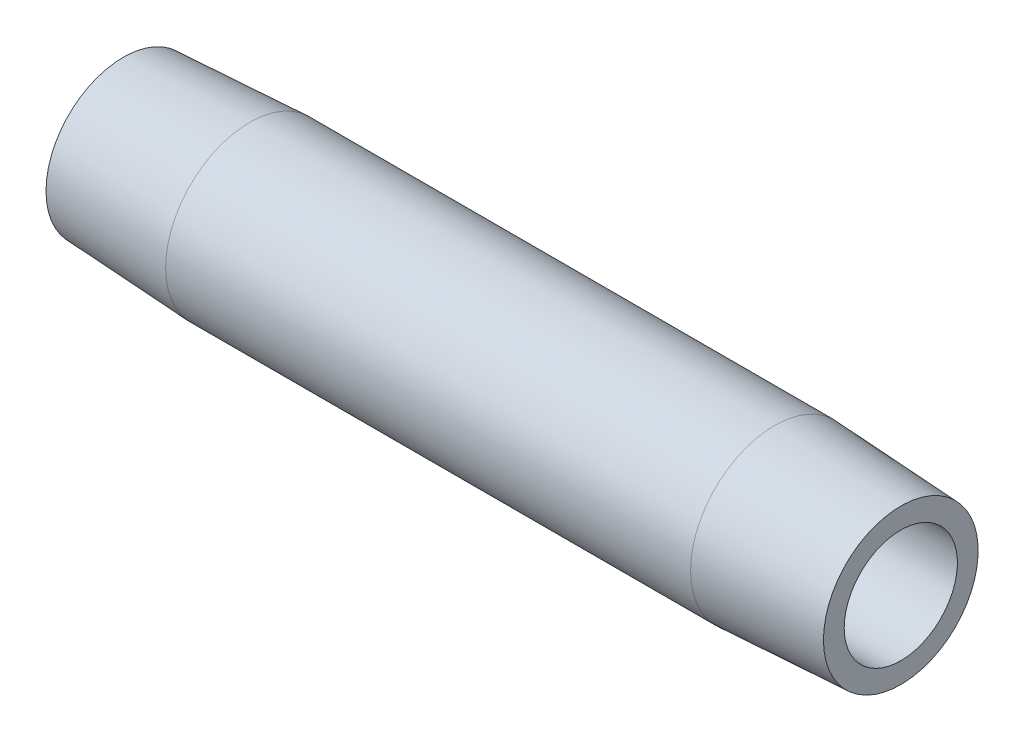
SolidWorks part; units mm, degrees
ref_plane "Front Plane" through (0, 0, 0) normal (0, 0, 1) x (1, 0, 0)
ref_plane "Top Plane" through (0, 0, 0) normal (0, 1, 0) x (1, 0, 0)
ref_plane "Right Plane" through (0, 0, 0) normal (1, 0, 0) x (0, 0, -1)
sketch "Sketch1" plane through (0, 0, 0) normal (0, 1, 0) x (1, 0, 0)
  line L6 (63.5, 4.6228) -> (0, 4.6228)
  line L7 (10.3124, 6.858) -> (0, 6.3175)
  line L8 (0, 6.3175) -> (0, 4.6228)
  line L9 (53.1876, 6.858) -> (10.3124, 6.858)
  line L10 (63.5, 6.3175) -> (53.1876, 6.858)
  line L11 (63.5, 4.6228) -> (63.5, 6.3175)
  line L12 (-6.376, 0) -> (49993.624, 0) construction
  dimension "D1" = 9.2456
  dimension "D2" = 13.716
  dimension "D3" = 3
  dimension "D4" = 3
  dimension "D5" = 63.5
  dimension "D6" = 10.3124
  dimension "D7" = 10.3124
revolve "Revolve1" add sketch "Sketch1" angle 360 about L12
